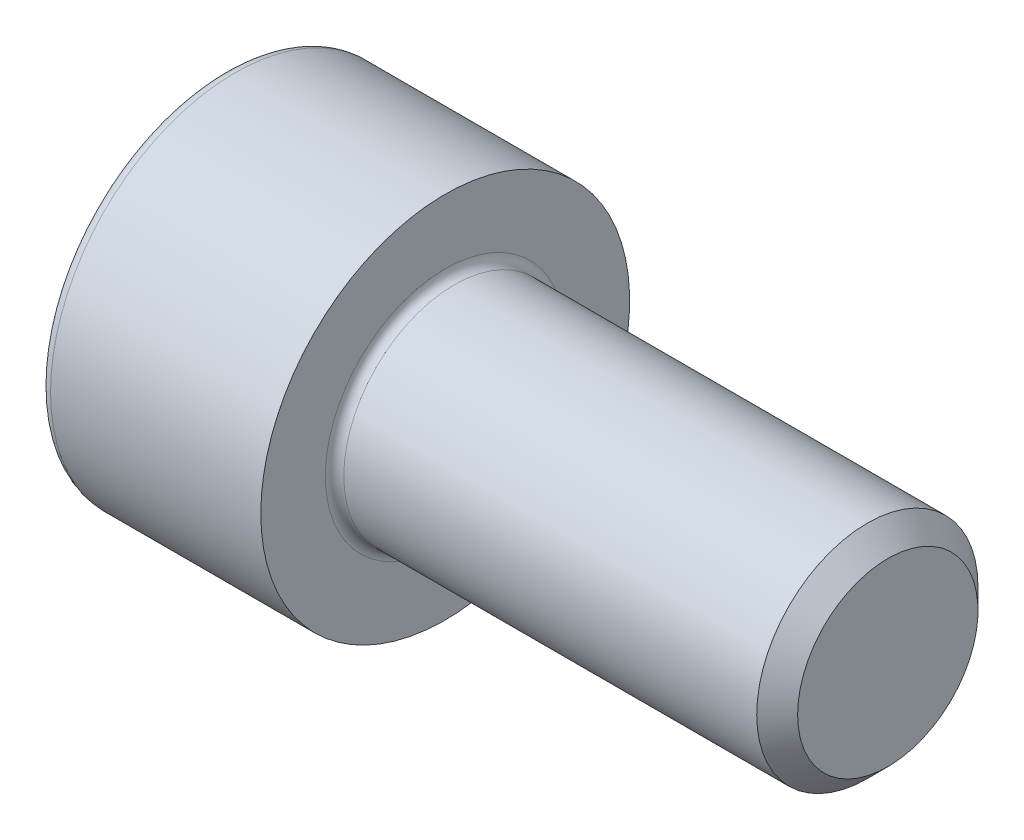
SolidWorks part; units mm, degrees
ref_plane "Plane1" through (0, 0, 0) normal (0, 0, 1) x (1, 0, 0)
ref_plane "Plane2" through (0, 0, 0) normal (0, 1, 0) x (1, 0, 0)
ref_plane "Plane3" through (0, 0, 0) normal (1, 0, 0) x (0, 0, -1)
sketch "BodySke" plane through (0, 0, 0) normal (0, 0, 1) x (1, 0, 0)
  line L0 (0, 0) -> (0, 5)
  line L1 (0, 5) -> (6, 5)
  line L2 (6, 5) -> (6, 3)
  line L3 (6, 3) -> (17.4455, 3)
  line L4 (18, 2.4455) -> (18, 0)
  line L5 (18, 0) -> (0, 0)
  line L6 (-31.75, 0) -> (127, 0) construction
  line L8 (18, 2.4455) -> (17.4455, 3)
  line L10 (18, -2.4455) -> (17.4455, -3) construction
  line L11 (7, 9.525) -> (7, 3.175) construction
  line L12 (6, 9.525) -> (6, 3.175) construction
  line L13 (-42, 9.525) -> (-42, 3.175) construction
  dimension "Diameter" = 6
  dimension "Head_ht" = 6
  dimension "Length" = 12
  dimension "Body_ch_ang" = 45
  dimension "Head_dia" = 10
  dimension "Minor_dia" = 4.891
  dimension "Advance" = 1
  dimension "Thread_nom" = 12
  dimension "Thread_length" = 60
revolve "Base-Revolve" add sketch "BodySke"
fillet "Fillet1" radius 0.25 1 edges at (6, 0, 3)
fillet "Fillet2" radius 0.3 1 edges at (0, 0, 5)
sketch "Sketch2" plane through (0, 0, 0) normal (0, 0, 1) x (1, 0, 0)
  line L0 (0, 2.542) -> (3, 2.542)
  line L1 (3, 2.542) -> (4.4676, 0)
  line L2 (-31.75, 0) -> (127, 0) construction
  line L3 (4.4676, 0) -> (0, 0)
  line L4 (0, 0) -> (0, 2.542)
  line L6 (0, 0) -> (47.625, 0) construction
  dimension "D1" = 2.542
  dimension "D2" = 60
  dimension "Depth" = 3
revolve "Hex-PreBroach" cut sketch "Sketch2" angle 360 about L6
sketch "Sketch3" plane through (0, 0, 0) normal (-1, 0, 0) x (0, 0.5, 0.866)
  line L0 (1.4676, 2.542) -> (-1.4676, 2.542)
  line L1 (-1.4676, 2.542) -> (-2.9352, 0)
  line L2 (1.4676, 2.542) -> (2.9352, 0)
  line L3 (1.4676, -2.542) -> (2.9352, 0)
  line L4 (1.4676, -2.542) -> (-1.4676, -2.542)
  line L5 (-1.4676, -2.542) -> (-2.9352, 0)
  dimension "D1" = 2.542
  dimension "D2" = 2.542
  dimension "Hex_size" = 5.084
extrude "Hex" cut sketch "Sketch3" against normal blind 3
sketch "ThdSchSke" plane through (0, 0, 0) normal (0, 0, 1) x (1, 0, 0)
  line L0 (9, -2.4455) -> (8.6117, -3)
  line L1 (9, -2.4455) -> (9.3883, -3)
  line L2 (9.3883, -3) -> (9.3883, -3.75)
  line L3 (-3.175, 0) -> (5.1513, 0) construction
  line L4 (0, 4.7) -> (0, -4.7) construction
  line L5 (9.3883, -3.75) -> (8.6117, -3.75)
  line L6 (8.6117, -3.75) -> (8.6117, -3)
  dimension "Thread_minor" = 4.891
  dimension "Diameter" = 6
  dimension "Start" = 9
  dimension "SideAngle" = 55
  dimension "VeeAngle" = 70
  dimension "Overcut" = 7.5
revolve "ThreadSchematic" [suppressed] cut sketch "ThdSchSke" angle 360 about L3
pattern_linear "ThdSchPat" [suppressed]
equation "\"D2@Sketch3\" = \"Hex_size@Sketch3\" / 2"
equation "\"D1@Sketch3\" = \"Hex_size@Sketch3\" / 2"
equation "\"D1@Sketch2\" = \"Hex_size@Sketch3\" / 2"
equation "\"Thread_minor@ThreadCosmetic\"  =  \"Minor_dia@BodySke\""
equation "\"Depth@Sketch2\" =  \"Key_eng@Hex\""
equation "\"Thread_length@ThreadCosmetic\" = ((sgn( (\"Length@BodySke\" - \"Advance@BodySke\" * 3.0) - \"Thread_nom@BodySke\" )-1)*( (\"Length@BodySke\" - \"Advance@BodySke\" * 3.0) - \"Thread_nom@BodySke\" ))/-2+ \"Thread_no"
equation "\"Thread_minor@ThdSchSke\" = \"Minor_dia@BodySke\""
equation "\"Diameter@ThdSchSke\" = \"Diameter@BodySke\""
equation "\"Overcut@ThdSchSke\" = \"Diameter@BodySke\" * 1.25"
equation "\"Start@ThdSchSke\" = \"Head_ht@BodySke\" + \"Length@BodySke\" - \"Thread_length@ThreadCosmetic\"  '---Non-countersunk---"
equation "\"Num_threads@ThdSchPat\" = int( \"Thread_length@ThreadCosmetic\" / \"Advance@BodySke\" + 0.999 )  + 1"
equation "\"Advance@ThdSchPat\" = \"Thread_length@ThreadCosmetic\" /  (\"Num_threads@ThdSchPat\" - 1) 'relax it"
equation "\"Num_threads@ThdSchPat\" = \"Num_threads@ThdSchPat\" - sgn( \"Num_threads@ThdSchPat\" - 1) '---chamfered tips only---"
